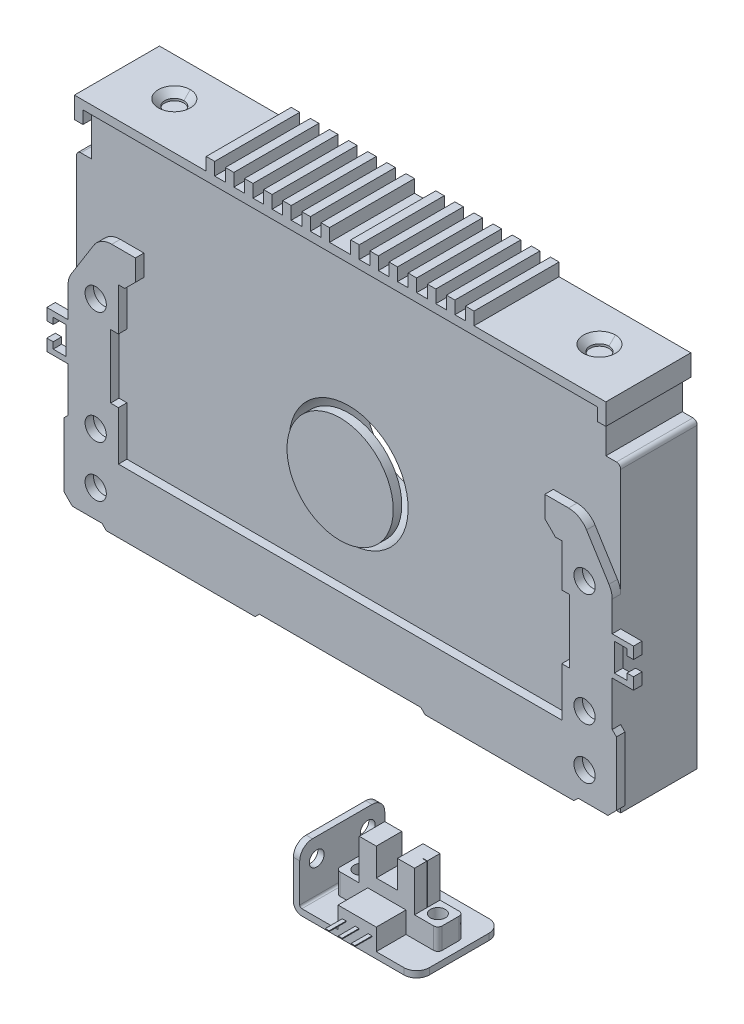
SolidWorks part; units mm, degrees
ref_plane "前视基准面" through (0, 0, 0) normal (0, 0, 1) x (1, 0, 0)
ref_plane "上视基准面" through (0, 0, 0) normal (0, 1, 0) x (1, 0, 0)
ref_plane "右视基准面" through (0, 0, 0) normal (1, 0, 0) x (0, 0, -1)
imported_body "输入1"
sketch "草图1" plane through (0, -26.631, 0) normal (0, -1, 0) x (1, 0, 0)
  line L0 (9.1742, -379) -> (9.1742, -250.3801)
  line L1 (9.1742, -319) -> (9.1742, -381) construction
  line L2 (9.1742, 192) -> (9.1742, -299) construction
  line L3 (9.1742, -250.3801) -> (117.4157, -250.3801)
  line L4 (117.4157, -250.3801) -> (117.4157, 444.4575)
  line L5 (117.4157, 444.4575) -> (-203.3939, 444.4575)
  line L6 (-203.3939, 444.4575) -> (-203.3939, -379)
  line L7 (-203.3939, -379) -> (9.1742, -379)
  line L8 (4.1742, -399) -> (-123.8258, -399) construction
  dimension "D1" = 20
extrude "切除-拉伸1" cut sketch "草图1" against normal up to surface (88 mm away)
